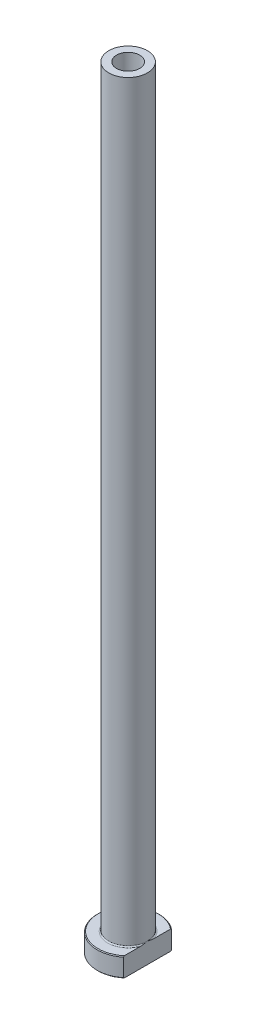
SolidWorks part; units mm, degrees
ref_plane "Front Plane" through (0, 0, 0) normal (0, 0, 1) x (1, 0, 0)
ref_plane "Top Plane" through (0, 0, 0) normal (0, 1, 0) x (1, 0, 0)
ref_plane "Right Plane" through (0, 0, 0) normal (1, 0, 0) x (0, 0, -1)
sketch "Sketch1" plane through (0, 0, 0) normal (0, 0, 1) x (1, 0, 0)
  line L0 (-3, 200) -> (-5, 200)
  line L1 (-5, 200) -> (-5, 5)
  line L2 (-5, 5) -> (-8, 5)
  line L3 (-8, 5) -> (-8, 0)
  line L4 (7.15, 0) -> (-7.15, 0) construction
  line L5 (-8, 0) -> (-3.25, 0)
  line L6 (-3, 155) -> (-3, 200)
  line L7 (0, 92.1877) -> (0, -15.5353) construction
  line L8 (0, -8.8) -> (0, 8.8) construction
  line L9 (-3, 155) -> (-3.25, 143)
  line L10 (-3.25, 143) -> (-3.25, 0)
  dimension "D1" = 0.25
  dimension "ID" = 6
  dimension "OD" = 10
  dimension "L" = 200
  dimension "H" = 16
  dimension "T" = 5
  dimension "N" = 45
  dimension "D2" = 12
  dimension "L-N" = 155
revolve "Revolve1" add sketch "Sketch1" angle 360 about L7
fillet "Fillet1" radius 0.3 1 edges at (0, 5, 5)
chamfer "Chamfer1" distance 0.2 angle 45 2 edges at (0, 5, 8) (0, 0, 8)
sketch "Sketch2" plane through (0, 0, 0) normal (0, -1, 0) x (1, 0, 0)
  line L0 (5, 6.245) -> (5, -6.245)
  circle A0 centre (0, 0) radius 8 construction
  arc A1 (5, 6.245) -> (5, -6.245) centre (0, 0) cw
  circle A2 centre (0, 0) radius 5 construction
extrude "Cut-Extrude1" cut sketch "Sketch2" against normal through all
chamfer "Chamfer2" distance 0.5 angle 45 1 edges at (0, 0, 3.25)
